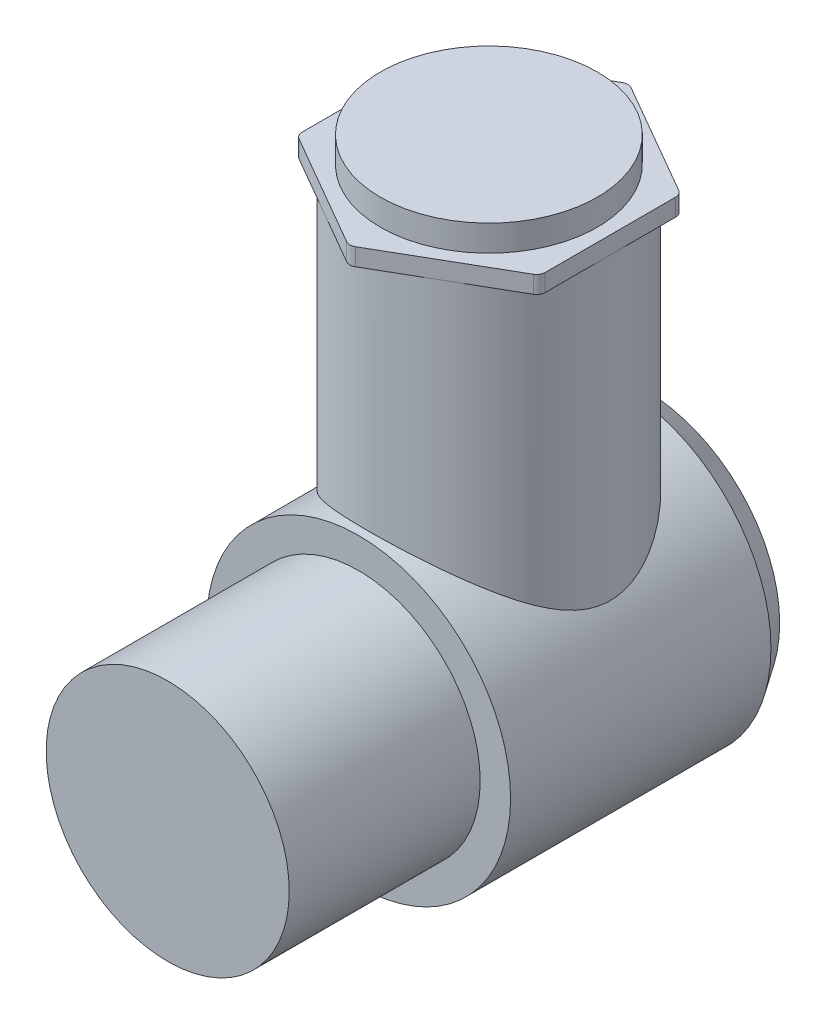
SolidWorks part; units mm, degrees
ref_plane "Front Plane" through (0, 0, 0) normal (0, 0, 1) x (1, 0, 0)
ref_plane "Top Plane" through (0, 0, 0) normal (0, 1, 0) x (1, 0, 0)
ref_plane "Right Plane" through (0, 0, 0) normal (1, 0, 0) x (0, 0, -1)
sketch "Sketch1" plane through (0, 0, 0) normal (0, 0, 1) x (1, 0, 0)
  circle A0 centre (0, 0) radius 175
extrude "Boss-Extrude1" add sketch "Sketch1" along normal mid plane 300
sketch "Sketch2" plane through (0, 0, 150) normal (0, 0, 1) x (1, 0, 0)
  circle A0 centre (0, 0) radius 140
extrude "Boss-Extrude2" add sketch "Sketch2" along normal blind 220
sketch "Sketch3" plane through (0, 0, 0) normal (0, 1, 0) x (1, 0, 0)
  circle A0 centre (0, 0) radius 140
extrude "Boss-Extrude3" add sketch "Sketch3" along normal blind 450
sketch "Sketch4" plane through (0, 450, 0) normal (0, 1, 0) x (1, 0, 0)
  line L7 (140, -80.829) -> (140, 80.829)
  line L8 (140, 80.829) -> (0, 161.6581)
  line L9 (0, 161.6581) -> (-140, 80.829)
  line L10 (-140, 80.829) -> (-140, -80.829)
  line L11 (-140, -80.829) -> (0, -161.6581)
  line L12 (0, -161.6581) -> (140, -80.829)
  circle A0 centre (0, 0) radius 140 construction
extrude "Boss-Extrude4" add sketch "Sketch4" along normal blind 20
sketch "Sketch5" plane through (0, 470, 0) normal (0, 1, 0) x (1, 0, 0)
  circle A0 centre (0, 0) radius 125
  dimension "D1" = 250
extrude "Boss-Extrude5" add sketch "Sketch5" along normal blind 30
sketch "Sketch6" plane through (0, 0, -150) normal (0, 0, -1) x (-1, 0, 0)
  circle A0 centre (0, 0) radius 155
extrude "Boss-Extrude6" add sketch "Sketch6" along normal blind 30
loft "Loft1" add
fillet "Fillet1" radius 10 6 edges at (0, 460, 161.6581) (-140, 460, 80.829) (0, 460, -161.6581) (140, 460, -80.829) (140, 460, 80.829) (-140, 460, -80.829)
equation "\"connector1_l\"= 250"
equation "\"connector1_d\"= 350"
equation "\"connector2_l\"= 220"
equation "\"connector2_d\"= 280"
equation "\"member1_d\"= 350"
equation "\"member2_d\"= 280"
equation "\"end_l\" = 375"
equation "\"end_d\" = 420"
equation "\"p1_m2_l\" = 250"
equation "\"p1_m1_l\" = 200"
equation "\"p2_m_l\" = 7500"
equation "\"p3_m_l\" = 4000"
equation "\"p3_offset\" = 400"
equation "\"end2_l\" = 300"
equation "\"end2_d\" = 350"
equation "\"p4_m_l\" = 3500"
equation "\"D1@Sketch1\"=\"end2_d\""
equation "\"D1@Boss-Extrude1\"=\"end2_l\""
equation "\"D1@Sketch2\"=\"connector2_d\""
equation "\"D1@Boss-Extrude2\"=\"connector2_l\""
equation "\"D1@Sketch3\"=\"member2_d\""
equation "\"D1@Sketch6\"=\"end2_d\"-40"
equation "\"base_h\" = 400"
equation "\"end_cap\" = 30"
equation "\"D1@Boss-Extrude6\"=\"end_cap\""
